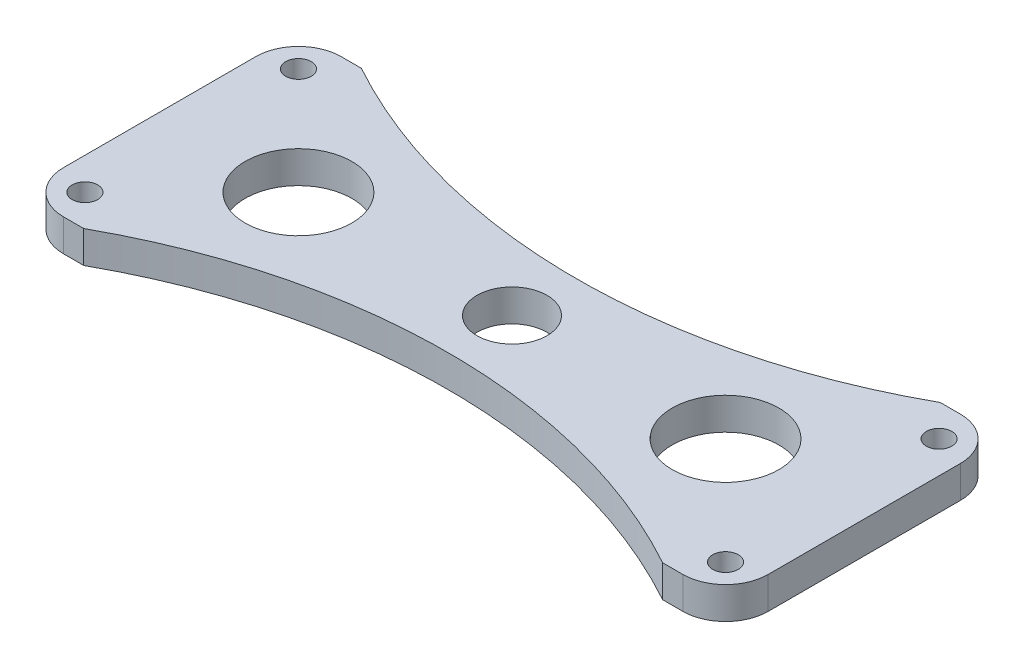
SolidWorks part; units mm, degrees
ref_plane "Front" through (0, 0, 0) normal (0, 0, 1) x (1, 0, 0)
ref_plane "Top" through (0, 0, 0) normal (0, 1, 0) x (1, 0, 0)
ref_plane "Right" through (0, 0, 0) normal (1, 0, 0) x (0, 0, -1)
sketch "Sketch1" plane through (0, 0, 0) normal (0, 1, 0) x (1, 0, 0)
  line L0 (52.3875, 20.6375) -> (-52.3875, -20.6375) construction
  line L1 (-52.3875, 20.6375) -> (52.3875, 20.6375)
  line L2 (-52.3875, 20.6375) -> (-52.3875, -20.6375)
  line L3 (-52.3875, -20.6375) -> (52.3875, -20.6375)
  line L4 (52.3875, 20.6375) -> (52.3875, -20.6375)
  circle A0 centre (0, 0) radius 5.207
  dimension "D1" = 10.414
  dimension "D2" = 104.775
  dimension "D3" = 41.275
extrude "Extrude1" add sketch "Sketch1" along normal blind 4.7625
hole_wizard "#6 Clearance Hole1" positions "Sketch3" profile "Sketch2" hole size "#6" standard "Ansi Inch"
sketch "Sketch3" plane through (0, 4.7625, 0) normal (0, 1, 0) x (-1, 0, 0)
  line L0 (0, 0) -> (0, 18.6605) construction
  line L1 (0, 18.6605) -> (18.2671, 18.6605) construction
  line L2 (18.2671, 18.6605) -> (18.2671, 0) construction
  line L3 (18.2671, 0) -> (0, 0) construction
  point P0 (47.625, -15.875)
  point P13 (47.625, 15.875)
  point P15 (-47.625, -15.875)
  point P16 (-47.625, 15.875)
  dimension "D1" = 95.25
  dimension "D2" = 31.75
sketch "Sketch2" plane through (-47.625, 4.7625, -15.875) normal (1, 0, 0) x (0, 0, 1)
  line L0 (0, 0) -> (0, 4.7625)
  line L1 (0, 4.7625) -> (1.8986, 4.7625)
  line L2 (1.8986, 4.7625) -> (1.8986, 0)
  line L5 (1.8986, 0) -> (0, 0)
  line L11 (0, -6.35) -> (0, 107.95) construction
  dimension "Thru Hole Dia." = 3.7973
  dimension "Thru Hole Depth" = 4.7625
fillet "Fillet1" radius 6.35 4 edges at (-52.3875, 2.3813, -20.6375) (-52.3875, 2.3813, 20.6375) (52.3875, 2.3813, -20.6375) (52.3875, 2.3813, 20.6375)
sketch "Sketch4" plane through (0, 4.7625, 0) normal (0, 1, 0) x (-1, 0, 0)
  line L0 (0, 0) -> (-35.2131, 0) construction
  line L1 (0, 9.525) -> (23.6101, 9.525) construction
  line L2 (0, 32.3334) -> (0, 0) construction
  circle A0 centre (0, 98.425) radius 88.9
  circle A1 centre (0, -98.425) radius 88.9
  circle A2 centre (-31.75, 0) radius 7.9375
  circle A3 centre (31.75, 0) radius 7.9375
  dimension "D2" = 177.8
  dimension "D3" = 15.875
  dimension "D4" = 63.5
  dimension "D1" = 9.525
extrude "Cut-Extrude1" cut sketch "Sketch4" against normal through all
